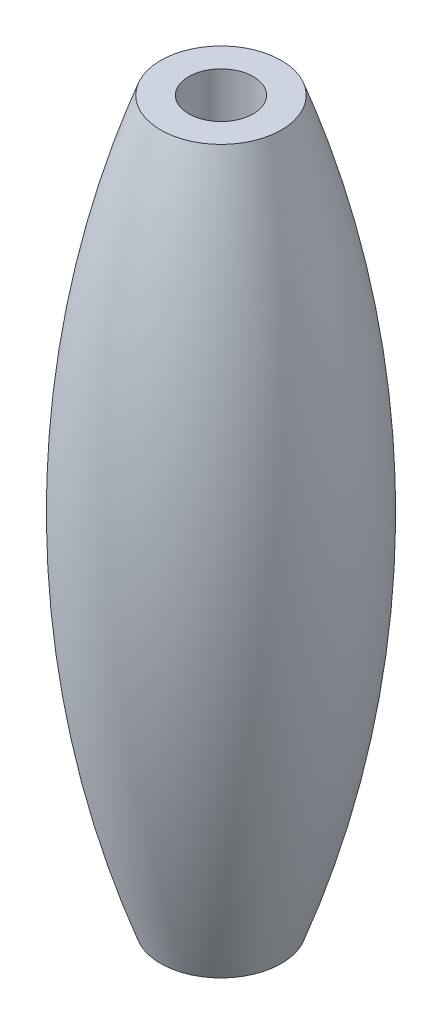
SolidWorks part; units mm, degrees
ref_plane "Front Plane" through (0, 0, 0) normal (0, 0, 1) x (1, 0, 0)
ref_plane "Top Plane" through (0, 0, 0) normal (0, 1, 0) x (1, 0, 0)
ref_plane "Right Plane" through (0, 0, 0) normal (1, 0, 0) x (0, 0, -1)
sketch "Sketch1" plane through (0, 0, 0) normal (0, 0, 1) x (1, 0, 0)
  line L0 (0, 0) -> (0, 24.3385) construction
  line L1 (0, 0) -> (11.6768, 0) construction
  line L2 (0, -19) -> (0, 19)
  line L3 (0, 19) -> (3.175, 19)
  line L4 (0, -19) -> (3.175, -19)
  arc A0 (3.175, 19) -> (3.175, -19) centre (-49.4482, 0) cw
  dimension "D3" = 13
  dimension "D1" = 38
  dimension "D2" = 6.35
revolve "Revolve1" add sketch "Sketch1" angle 360 about L0
hole_wizard "M3 Clearance Hole1" positions "Sketch3" profile "Sketch2" hole size "M3" standard "Ansi Metric"
sketch "Sketch3" plane through (0, 19, 0) normal (0, 1, 0) x (-1, 0, 0)
  point P0 (0, 0)
sketch "Sketch2" plane through (0, 19, 0) normal (1, 0, 0) x (0, 0, 1)
  line L0 (0, 0) -> (0, 38)
  line L1 (0, 38) -> (1.7, 38)
  line L2 (1.7, 38) -> (1.7, 0)
  line L5 (1.7, 0) -> (0, 0)
  line L11 (0, -6.35) -> (0, 107.95) construction
  dimension "Thru Hole Dia." = 3.4
  dimension "Thru Hole Depth" = 38
